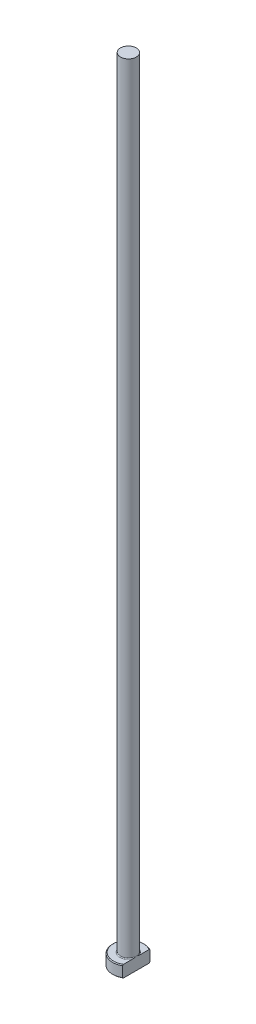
SolidWorks part; units mm, degrees
ref_plane "Front Plane" through (0, 0, 0) normal (0, 0, 1) x (1, 0, 0)
ref_plane "Top Plane" through (0, 0, 0) normal (0, 1, 0) x (1, 0, 0)
ref_plane "Right Plane" through (0, 0, 0) normal (1, 0, 0) x (0, 0, -1)
sketch "Sketch1" plane through (0, 0, 0) normal (0, 0, 1) x (1, 0, 0)
  line L0 (0, 259.9588) -> (0, -15.1925) construction
  line L1 (0, 0) -> (-4, 0)
  line L2 (-4, 0) -> (-4, 3)
  line L3 (-4, 3) -> (-2, 3)
  line L4 (-2, 3) -> (-2, 200)
  line L5 (-2, 200) -> (0, 200)
  line L6 (0, 200) -> (0, 0)
  dimension "L" = 200
  dimension "H" = 8
  dimension "T" = 3
  dimension "D" = 4
revolve "Revolve1" add sketch "Sketch1" angle 360 about L0
chamfer "Chamfer1" distance 0.2 angle 45 2 edges at (0, 3, 4) (0, 0, 4)
fillet "Fillet1" radius 0.2 1 edges at (0, 3, 2)
sketch "Sketch2" plane through (0, 0, 0) normal (0, 1, 0) x (1, 0, 0)
  line L0 (2, 3.4641) -> (2, -3.4641)
  circle A0 centre (0, 0) radius 4 construction
  arc A1 (2, -3.4641) -> (2, 3.4641) centre (0, 0) ccw
  circle A2 centre (0, 0) radius 2 construction
extrude "KEY" cut sketch "Sketch2" along normal through all
